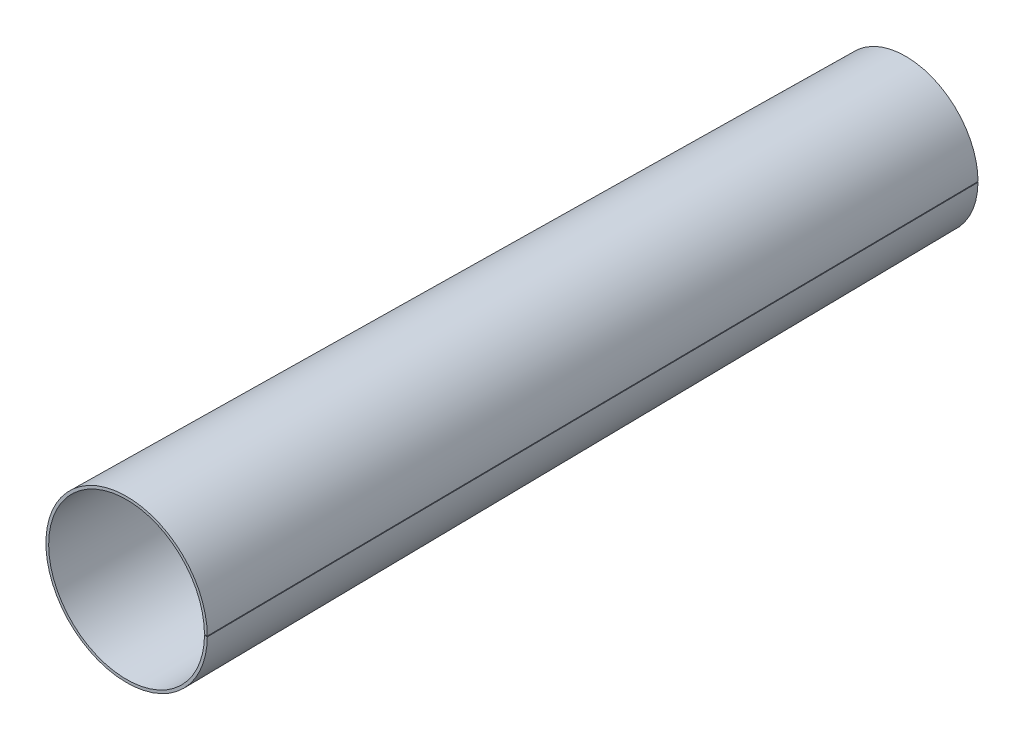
SolidWorks part; units mm, degrees
ref_plane "Ebene vorne" through (0, 0, 0) normal (0, 0, 1) x (1, 0, 0)
ref_plane "Ebene oben" through (0, 0, 0) normal (0, 1, 0) x (1, 0, 0)
ref_plane "Ebene rechts" through (0, 0, 0) normal (1, 0, 0) x (0, 0, -1)
ref_plane "Ebene1" through (0, 0, 280) normal (0, 0, 1) x (1, 0, 0)
sketch "Skizze1" plane through (0, 0, 0) normal (0, 0, 1) x (1, 0, 0)
  arc A0 (26, 0) -> (25.9988, -0.25) centre (0, 0) ccw
  dimension "D1" = 26
  dimension "D2" = 0.25
sketch "Skizze2" plane through (0, 0, 280) normal (0, 0, 1) x (1, 0, 0)
  arc A0 (29, 0) -> (28.9989, -0.25) centre (0, 0) ccw
  dimension "D1" = 29
  dimension "D2" = 0.25
sheet metal parameters "Blech3" thickness 1 parameters "D1"=26, "Dicke"=1
lofted bend "Ausgeformte Biegungen6" parameters "D1"=0, "D12"=1
other "Freiform-Biegung2" parameters "D1"=1000, "D4"=57.296, "D5"=1
